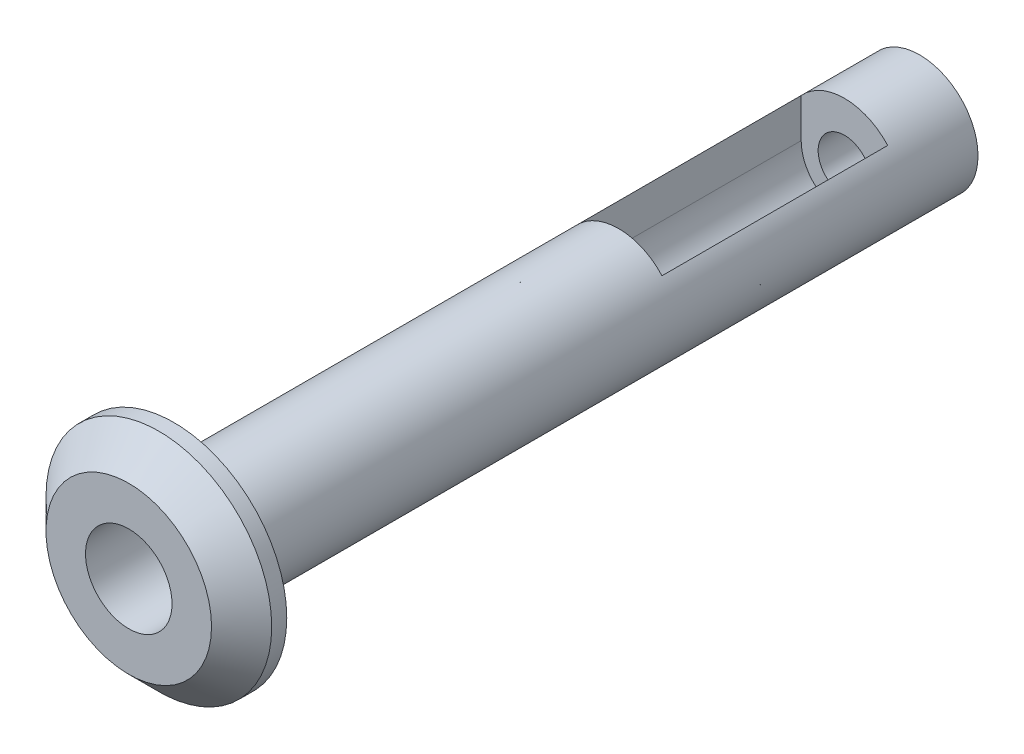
SolidWorks part; units mm, degrees
ref_plane "Alzado" through (0, 0, 0) normal (0, 0, 1) x (1, 0, 0)
ref_plane "Planta" through (0, 0, 0) normal (0, 1, 0) x (1, 0, 0)
ref_plane "Vista lateral" through (0, 0, 0) normal (1, 0, 0) x (0, 0, -1)
sketch "Croquis1" plane through (0, 0, 0) normal (0, 0, 1) x (1, 0, 0)
  circle A0 centre (0, 0) radius 7.5
  circle A1 centre (0, 0) radius 1.75
  dimension "D1" = 15
  dimension "D2" = 3.5
extrude "Saliente-Extruir1" add sketch "Croquis1" along normal mid plane 3
chamfer "Chaflán1" distance 2 angle 45 1 edges at (7.5, 0, 1.5)
sketch "Croquis2" plane through (0, 0, -1.5) normal (0, 0, -1) x (-1, 0, 0)
  circle A2 centre (0, 0) radius 1.75 construction
  circle A3 centre (0, 0) radius 1.75
  circle A4 centre (0, 0) radius 3.875
  dimension "D1" = 7.75
extrude "Saliente-Extruir2" add sketch "Croquis2" along normal blind 49.56
sketch "Croquis3" plane through (0, 0, 1.5) normal (0, 0, 1) x (1, 0, 0)
  circle A0 centre (0, 0) radius 2.875
  dimension "D1" = 5.75
extrude "Cortar-Extruir1" cut sketch "Croquis3" against normal offset from surface (47.56 mm away) 5
sketch "Croquis4" plane through (0, 0, -46.06) normal (0, 0, 1) x (1, 0, 0)
  line L0 (-2.875, 2.5981) -> (-2.875, 0)
  line L1 (-2.875, 0) -> (2.875, 0)
  line L2 (2.875, 0) -> (2.875, 2.5981)
  circle A0 centre (0, 0) radius 3.875 construction
  arc A1 (2.875, 2.5981) -> (-2.875, 2.5981) centre (0, 0) ccw
  circle A2 centre (0, 0) radius 2.875 construction
  arc A3 (-2.875, 2.5981) -> (2.875, 2.5981) centre (0, 0) ccw construction
extrude "Cortar-Extruir2" cut sketch "Croquis4" along normal blind 15
